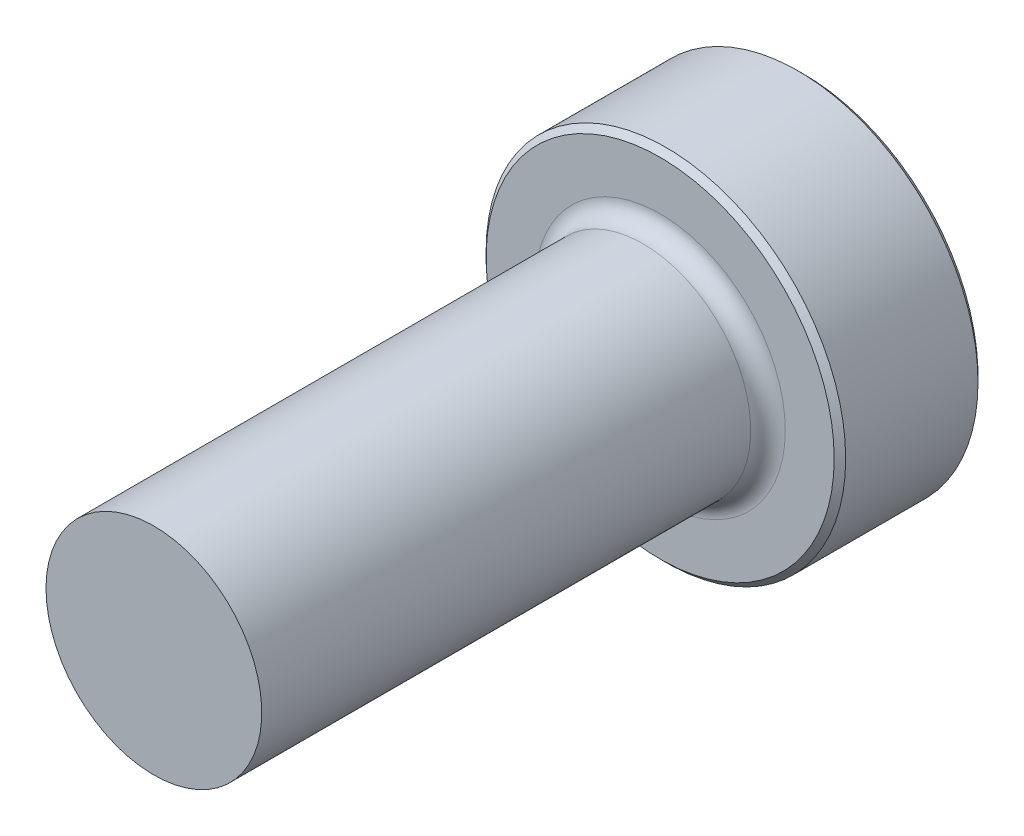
SolidWorks part; units mm, degrees
ref_plane "Front Plane" through (0, 0, 0) normal (0, 0, 1) x (1, 0, 0)
ref_plane "Top Plane" through (0, 0, 0) normal (0, 1, 0) x (1, 0, 0)
ref_plane "Right Plane" through (0, 0, 0) normal (1, 0, 0) x (0, 0, -1)
sketch "Sketch1" plane through (0, 0, 0) normal (1, 0, 0) x (0, 0, -1)
  line L0 (0, 0) -> (0, 7.9375)
  line L1 (0, 7.9375) -> (-6.35, 7.9375)
  line L2 (-6.35, 7.9375) -> (-6.35, 5.5245)
  line L3 (-7.112, 4.7625) -> (-28.702, 4.7625)
  line L4 (-28.702, 4.7625) -> (-28.702, 0)
  line L5 (-28.702, 0) -> (0, 0)
  line L6 (25.4347, 0) -> (-130.6739, 0) construction
  arc A0 (-6.35, 5.5245) -> (-7.112, 4.7625) centre (-7.112, 5.5245) cw
  dimension "D4" = 0.762
  dimension "D1" = 9.525
  dimension "D2" = 15.875
  dimension "D3" = 6.35
  dimension "D5" = 28.702
revolve "Revolve1" add sketch "Sketch1" angle 360 about L6
chamfer "Chamfer1" distance 0.254 angle 45 2 edges at (-7.9375, 0, 0) (-7.9375, 0, 6.35)
